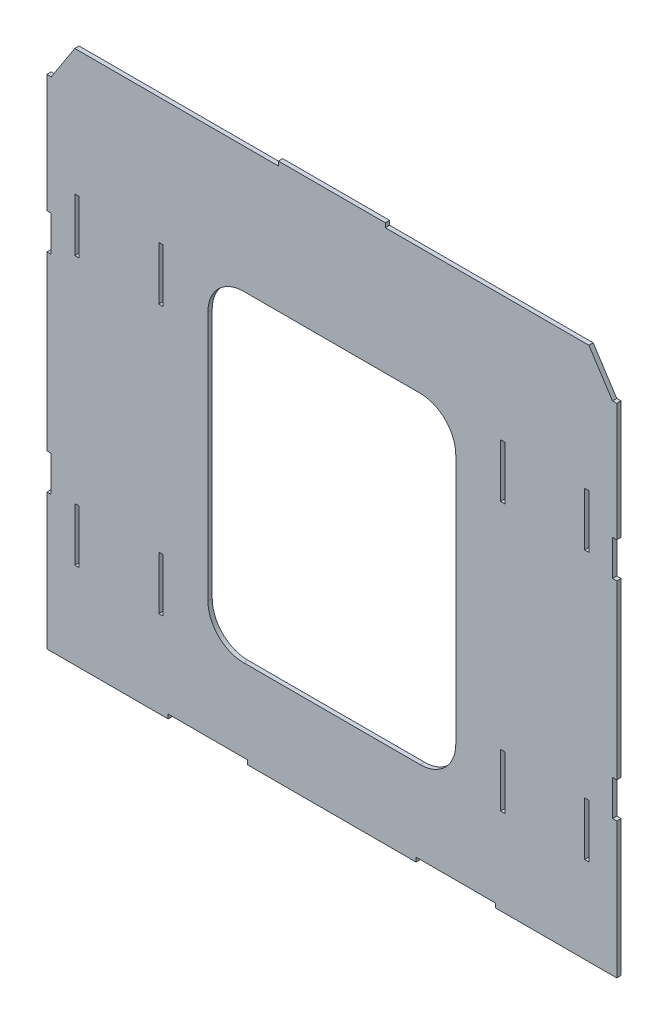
SolidWorks part; units mm, degrees
ref_plane "Front Plane" through (0, 0, 0) normal (0, 0, 1) x (1, 0, 0)
ref_plane "Top Plane" through (0, 0, 0) normal (0, 1, 0) x (1, 0, 0)
ref_plane "Right Plane" through (0, 0, 0) normal (1, 0, 0) x (0, 0, -1)
sketch "Sketch1" plane through (0, 0, 0) normal (0, 0, 1) x (1, 0, 0)
  line L0 (168.7113, 0) -> (168.7113, 1.524)
  line L1 (125.476, 0) -> (168.7113, 0)
  line L2 (125.476, 0) -> (125.476, 48.4688)
  line L3 (125.476, 177.4532) -> (127, 177.4532)
  line L4 (328.676, 0) -> (328.676, 48.4688)
  line L5 (168.7113, 1.524) -> (197.0629, 1.524)
  line L6 (197.0629, 1.524) -> (197.0629, 0)
  line L7 (257.0891, 0) -> (257.0891, 1.524)
  line L8 (125.476, 122.6306) -> (127, 122.6306)
  line L9 (125.476, 48.4688) -> (127, 48.4688)
  line L10 (257.0891, 1.524) -> (285.4407, 1.524)
  line L11 (285.4407, 1.524) -> (285.4407, 0)
  line L12 (285.4407, 0) -> (328.676, 0)
  line L13 (197.0629, 0) -> (257.0891, 0)
  line L14 (127, 135.3306) -> (127, 122.6306)
  line L15 (125.476, 61.1688) -> (125.476, 122.6306)
  line L16 (125.476, 135.3306) -> (127, 135.3306)
  line L17 (125.476, 61.1688) -> (127, 61.1688)
  line L18 (127, 48.4688) -> (127, 61.1688)
  line L19 (125.476, 135.3306) -> (125.476, 177.4532)
  line L20 (227.076, 170.7028) -> (227.076, 348.2415) construction
  line L21 (327.152, 48.4688) -> (327.152, 61.1688)
  line L22 (328.676, 61.1688) -> (327.152, 61.1688)
  line L23 (328.676, 48.4688) -> (327.152, 48.4688)
  line L24 (328.676, 135.3306) -> (327.152, 135.3306)
  line L25 (327.152, 135.3306) -> (327.152, 122.6306)
  line L26 (328.676, 122.6306) -> (327.152, 122.6306)
  line L27 (328.676, 135.3306) -> (328.676, 177.4532)
  line L28 (328.676, 61.1688) -> (328.676, 122.6306)
  line L29 (127, 177.4532) -> (135.4314, 190.4281)
  line L30 (135.4314, 190.4281) -> (208.026, 190.4281)
  line L31 (318.7206, 190.4281) -> (327.152, 177.4532)
  line L32 (328.676, 177.4532) -> (327.152, 177.4532)
  line L33 (208.026, 191.9521) -> (246.126, 191.9521)
  line L34 (246.126, 190.4281) -> (246.126, 191.9521)
  line L35 (208.026, 190.4281) -> (208.026, 191.9521)
  line L36 (246.126, 190.4281) -> (318.7206, 190.4281)
extrude "Boss-Extrude1" add sketch "Sketch1" along normal blind 1.524
sketch "Sketch2" plane through (0, 0, 1.524) normal (0, 0, 1) x (1, 0, 0)
  line L0 (182.8871, 88.176) -> (271.2649, 88.176) construction
  line L1 (195.5871, 30.8387) -> (258.5649, 30.8387)
  line L2 (182.8871, 43.5387) -> (182.8871, 132.8133)
  line L3 (195.5871, 145.5133) -> (258.5649, 145.5133)
  line L4 (271.2649, 43.5387) -> (271.2649, 132.8133)
  line L5 (166.8837, 30.8387) -> (165.3597, 30.8387)
  line L6 (166.8837, 30.8387) -> (166.8837, 49.8887)
  line L7 (166.8837, 49.8887) -> (165.3597, 49.8887)
  line L8 (165.3597, 30.8387) -> (165.3597, 49.8887)
  line L9 (227.076, 145.5133) -> (227.076, 30.8387) construction
  line L10 (165.3597, 145.5133) -> (165.3597, 126.4633)
  line L11 (166.8837, 126.4633) -> (165.3597, 126.4633)
  line L12 (166.8837, 145.5133) -> (166.8837, 126.4633)
  line L13 (166.8837, 145.5133) -> (165.3597, 145.5133)
  line L14 (287.2683, 145.5133) -> (288.7923, 145.5133)
  line L15 (287.2683, 145.5133) -> (287.2683, 126.4633)
  line L16 (287.2683, 126.4633) -> (288.7923, 126.4633)
  line L17 (288.7923, 145.5133) -> (288.7923, 126.4633)
  line L18 (288.7923, 30.8387) -> (288.7923, 49.8887)
  line L19 (287.2683, 49.8887) -> (288.7923, 49.8887)
  line L20 (287.2683, 30.8387) -> (287.2683, 49.8887)
  line L21 (287.2683, 30.8387) -> (288.7923, 30.8387)
  line L22 (136.9554, 30.8387) -> (136.9554, 49.8887) construction
  line L23 (318.7206, 145.5133) -> (317.1966, 145.5133)
  line L24 (318.7206, 145.5133) -> (318.7206, 126.4633)
  line L25 (318.7206, 126.4633) -> (317.1966, 126.4633)
  line L26 (317.1966, 145.5133) -> (317.1966, 126.4633)
  line L27 (318.7206, 30.8387) -> (317.1966, 30.8387)
  line L28 (318.7206, 30.8387) -> (318.7206, 49.8887)
  line L29 (318.7206, 49.8887) -> (317.1966, 49.8887)
  line L30 (317.1966, 30.8387) -> (317.1966, 49.8887)
  line L31 (135.4314, 30.8387) -> (136.9554, 30.8387)
  line L32 (135.4314, 30.8387) -> (135.4314, 49.8887)
  line L33 (135.4314, 49.8887) -> (136.9554, 49.8887)
  line L34 (136.9554, 30.8387) -> (136.9554, 49.8887)
  line L36 (135.4314, 145.5133) -> (136.9554, 145.5133)
  line L37 (135.4314, 145.5133) -> (135.4314, 126.4633)
  line L38 (135.4314, 126.4633) -> (136.9554, 126.4633)
  line L39 (136.9554, 145.5133) -> (136.9554, 126.4633)
  arc A0 (258.5649, 30.8387) -> (271.2649, 43.5387) centre (258.5649, 43.5387) ccw
  arc A1 (182.8871, 132.8133) -> (195.5871, 145.5133) centre (195.5871, 132.8133) cw
  arc A2 (258.5649, 145.5133) -> (271.2649, 132.8133) centre (258.5649, 132.8133) cw
  arc A3 (195.5871, 30.8387) -> (182.8871, 43.5387) centre (195.5871, 43.5387) cw
extrude "Cut-Extrude1" cut sketch "Sketch2" against normal blind 2.54
